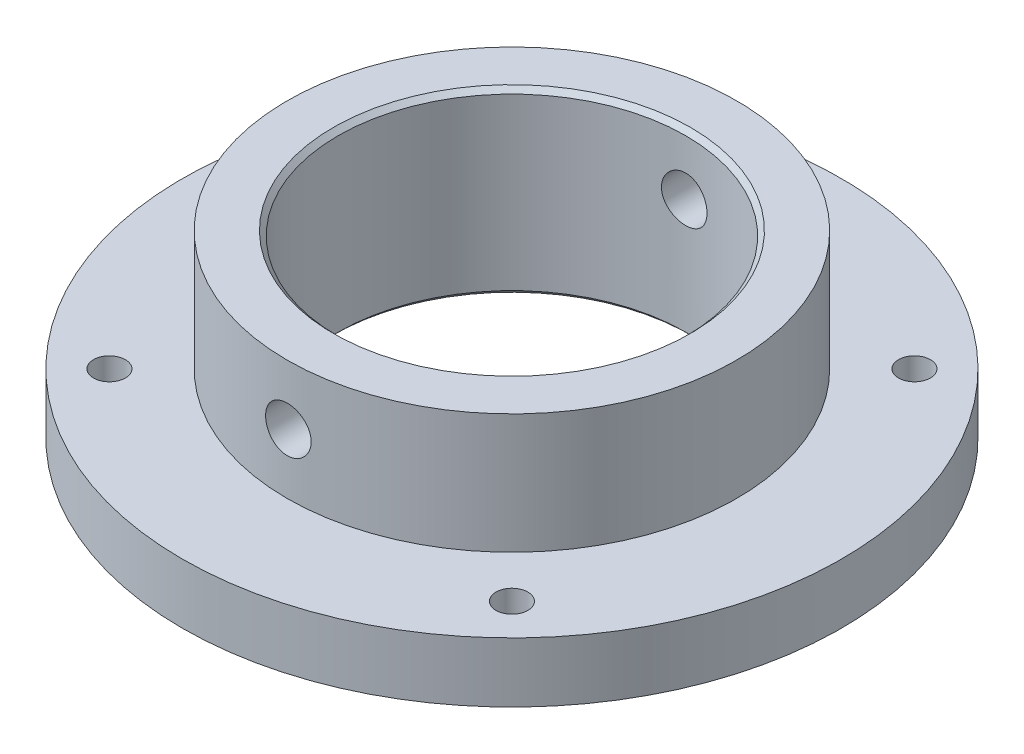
SolidWorks part; units mm, degrees
ref_plane "Front Plane" through (0, 0, 0) normal (0, 0, 1) x (1, 0, 0)
ref_plane "Top Plane" through (0, 0, 0) normal (0, 1, 0) x (1, 0, 0)
ref_plane "Right Plane" through (0, 0, 0) normal (1, 0, 0) x (0, 0, -1)
sketch "Sketch1" plane through (0, 0, 0) normal (0, 0, 1) x (1, 0, 0)
  line L0 (0, 0) -> (0, -59.8277) construction
  line L1 (36.83, 0) -> (47.625, 0)
  line L2 (47.625, 0) -> (47.625, -25.4)
  line L3 (47.625, -25.4) -> (69.85, -25.4)
  line L4 (69.85, -25.4) -> (69.85, -38.1)
  line L5 (69.85, -38.1) -> (36.83, -38.1)
  line L6 (36.83, 0) -> (36.83, -38.1)
  dimension "D1" = 36.83
  dimension "D2" = 38.1
  dimension "D3" = 25.4
  dimension "D4" = 47.625
  dimension "D5" = 69.85
revolve "Revolve1" add sketch "Sketch1" angle 360 about L0
chamfer "Chamfer1" distance 1.016 angle 45 2 edges at (0, 0, 36.83) (0, -38.1, 36.83)
sketch "Sketch2" plane through (0, 0, 0) normal (0, 0, 1) x (1, 0, 0)
  line L0 (37.846, 0) -> (-37.846, 0) construction
  circle A0 centre (0, -12.7) radius 4.826
  dimension "D1" = 12.7
extrude "Cut-Extrude1" cut sketch "Sketch2" against normal mid plane 96.52
sketch "Sketch3" plane through (0, 0, 0) normal (0, 1, 0) x (1, 0, 0)
  line L0 (0, 0) -> (-76.3836, 76.3836) construction
  line L1 (0, 0) -> (0, 87.5474) construction
  circle A0 centre (-42.6562, 42.6562) radius 3.3782
  dimension "D2" = 60.325
  dimension "D1" = 45
extrude "Cut-Extrude2" cut sketch "Sketch3" against normal through all
pattern_circular "CirPattern1" count 4 over 360 about axis through (0, 0, 0) along (0, 1, 0) of "Cut-Extrude2"
